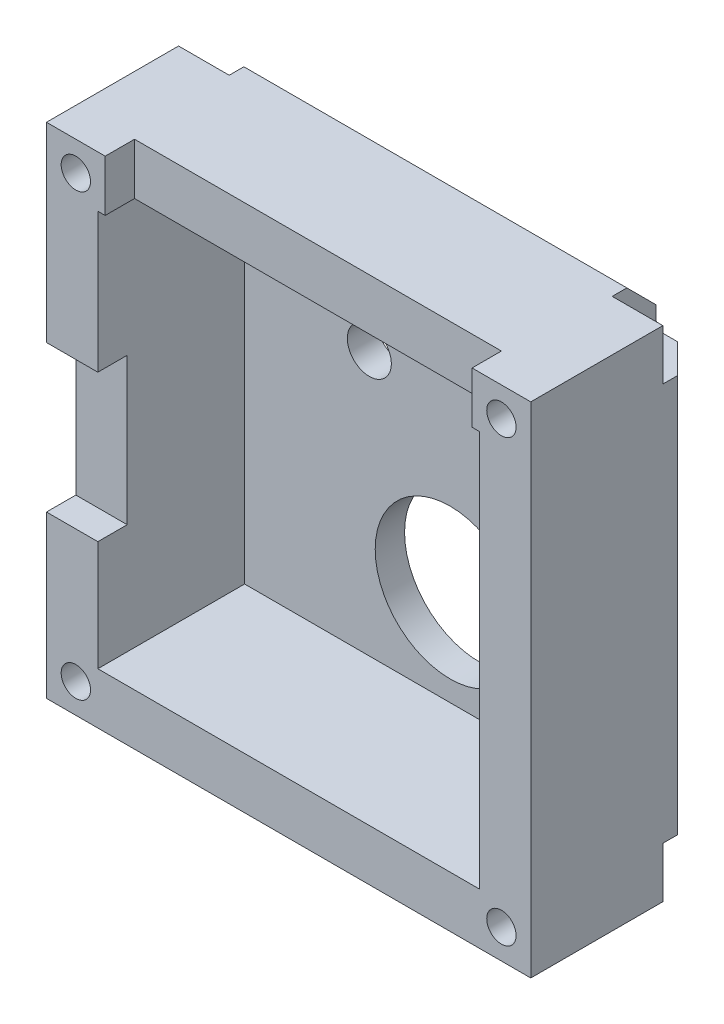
SolidWorks part; units mm, degrees
ref_plane "Alzado" through (0, 0, 0) normal (0, 0, 1) x (1, 0, 0)
ref_plane "Planta" through (0, 0, 0) normal (0, 1, 0) x (1, 0, 0)
ref_plane "Vista lateral" through (0, 0, 0) normal (1, 0, 0) x (0, 0, -1)
sketch "Sketch1" plane through (0, 0, 0) normal (0, 0, 1) x (1, 0, 0)
  line L1 (-16.5, -17) -> (16.5, -17)
  line L2 (-16.5, -17) -> (-16.5, 17)
  line L3 (-16.5, 17) -> (16.5, 17)
  line L4 (16.5, -17) -> (16.5, 17)
  line L5 (-16.5, -17) -> (16.5, 17) construction
  line L6 (-16.5, 17) -> (16.5, -17) construction
  line L7 (-13, -13.5) -> (13, -13.5)
  line L8 (-13, -13.5) -> (-13, 13.5)
  line L9 (-13, 13.5) -> (13, 13.5)
  line L10 (13, -13.5) -> (13, 13.5)
  line L11 (-13, -13.5) -> (13, 13.5) construction
  line L12 (-13, 13.5) -> (13, -13.5) construction
  point P0 (0, 0)
  point P6 (0, 0)
  dimension "D1" = 33
  dimension "D2" = 34
  dimension "D3" = 3.5
  dimension "D4" = 3.5
extrude "Boss-Extrude1" add sketch "Sketch1" along normal blind 10
sketch "Sketch2" plane through (0, 0, 0) normal (0, 0, -1) x (-1, 0, 0)
  line L1 (-16.5, -17) -> (16.5, -17)
  line L2 (-16.5, -17) -> (-16.5, 17)
  line L3 (-16.5, 17) -> (16.5, 17)
  line L4 (16.5, -17) -> (16.5, 17)
  line L5 (-16.5, -17) -> (16.5, 17) construction
  line L6 (-16.5, 17) -> (16.5, -17) construction
  point P0 (0, 0)
extrude "Boss-Extrude2" add sketch "Sketch2" along normal blind 2
sketch "Sketch3" plane through (0, 0, -2) normal (0, 0, -1) x (-1, 0, 0)
  line L0 (16.5, 17) -> (-16.5, 17) construction
  line L1 (-16.5, 17) -> (-16.5, -17) construction
  line L2 (0, 5.7661) -> (0, -4.1628) construction
  line L3 (-6.2358, 0) -> (6.5699, 0) construction
  circle A0 centre (-14.5, 15) radius 1
  circle A1 centre (14.5, 15) radius 1
  circle A2 centre (14.5, -15) radius 1
  circle A3 centre (-14.5, -15) radius 1
  dimension "D1" = 2
  dimension "D2" = 2
  dimension "D3" = 2
extrude "Cut-Extrude1" cut sketch "Sketch3" against normal blind 21
sketch "Sketch4" plane through (0, 0, -2) normal (0, 0, -1) x (-1, 0, 0)
  line L1 (-2.1982, 0) -> (3.1898, 0) construction
  line L2 (-16.5, 17) -> (-13.05, 17)
  line L3 (-16.5, 17) -> (-16.5, 13.55)
  line L4 (-16.5, 13.55) -> (-13.05, 13.55)
  line L5 (-13.05, 17) -> (-13.05, 13.55)
  line L6 (0, 3.809) -> (0, -1.5654) construction
  line L7 (13.05, 17) -> (13.05, 13.55)
  line L8 (16.5, 13.55) -> (13.05, 13.55)
  line L9 (16.5, 17) -> (16.5, 13.55)
  line L10 (16.5, 17) -> (13.05, 17)
  line L11 (16.5, -17) -> (13.05, -17)
  line L12 (16.5, -17) -> (16.5, -13.55)
  line L13 (16.5, -13.55) -> (13.05, -13.55)
  line L14 (13.05, -17) -> (13.05, -13.55)
  line L15 (-13.05, -17) -> (-13.05, -13.55)
  line L16 (-16.5, -13.55) -> (-13.05, -13.55)
  line L17 (-16.5, -17) -> (-16.5, -13.55)
  line L18 (-16.5, -17) -> (-13.05, -17)
  dimension "D1" = 3.45
  dimension "D2" = 3.45
extrude "Cut-Extrude2" cut sketch "Sketch4" against normal blind 3
chamfer "Chamfer1" distance 2 angle 45 4 edges at (-16.5, 0, -2) (0, -17, -2) (16.5, 0, -2) (0, 17, -2)
fillet "Fillet1" radius 0.5 4 edges at (-13.05, 13.55, -0.5) (-13.05, -13.55, -0.5) (13.05, -13.55, -0.5) (13.05, 13.55, -0.5)
sketch "Sketch5" plane through (0, 17, 0) normal (0, 1, 0) x (1, 0, 0)
  line L0 (16.5, -10) -> (-16.5, -10) construction
  line L1 (-12.5, -8) -> (12.5, -8)
  line L2 (-12.5, -8) -> (-12.5, -12)
  line L3 (-12.5, -12) -> (12.5, -12)
  line L4 (12.5, -8) -> (12.5, -12)
  line L5 (-12.5, -8) -> (12.5, -12) construction
  line L6 (-12.5, -12) -> (12.5, -8) construction
  point P0 (0, -10)
  dimension "D1" = 25
  dimension "D2" = 4
extrude "Cut-Extrude3" cut sketch "Sketch5" against normal blind 8
sketch "Sketch6" plane through (-16.5, 0, 0) normal (-1, 0, 0) x (0, 0, 1)
  line L0 (10, 17) -> (10, -17) construction
  line L1 (8, 4) -> (12, 4)
  line L2 (8, 4) -> (8, -6)
  line L3 (8, -6) -> (12, -6)
  line L4 (12, 4) -> (12, -6)
  line L5 (8, 4) -> (12, -6) construction
  line L6 (8, -6) -> (12, 4) construction
  line L7 (10, -17) -> (1, -17) construction
  point P0 (10, -1)
  dimension "D1" = 11
  dimension "D2" = 10
  dimension "D3" = 4
extrude "Cut-Extrude4" cut sketch "Sketch6" against normal blind 8
sketch "Sketch7" plane through (0, 0, -2) normal (0, 0, -1) x (-1, 0, 0)
  line L9 (13.05, -17) -> (-13.05, -17) construction
  line L10 (16.5, 13.55) -> (16.5, -13.55) construction
  line L11 (-16.5, -13.55) -> (-16.5, 13.55) construction
  circle A6 centre (4.5, 4.5) radius 1.5
  circle A7 centre (-10.5, 5.5) radius 1.5
  circle A8 centre (-1, -7) radius 5.1
  dimension "D2" = 10
  dimension "D3" = 15.5
  dimension "D10" = 3
  dimension "D13" = 3
  dimension "D16" = 10.2
  dimension "D11" = 12
  dimension "D12" = 21.5
  dimension "D14" = 6
  dimension "D15" = 22.5
extrude "Cut-Extrude5" cut sketch "Sketch7" against normal blind 8
